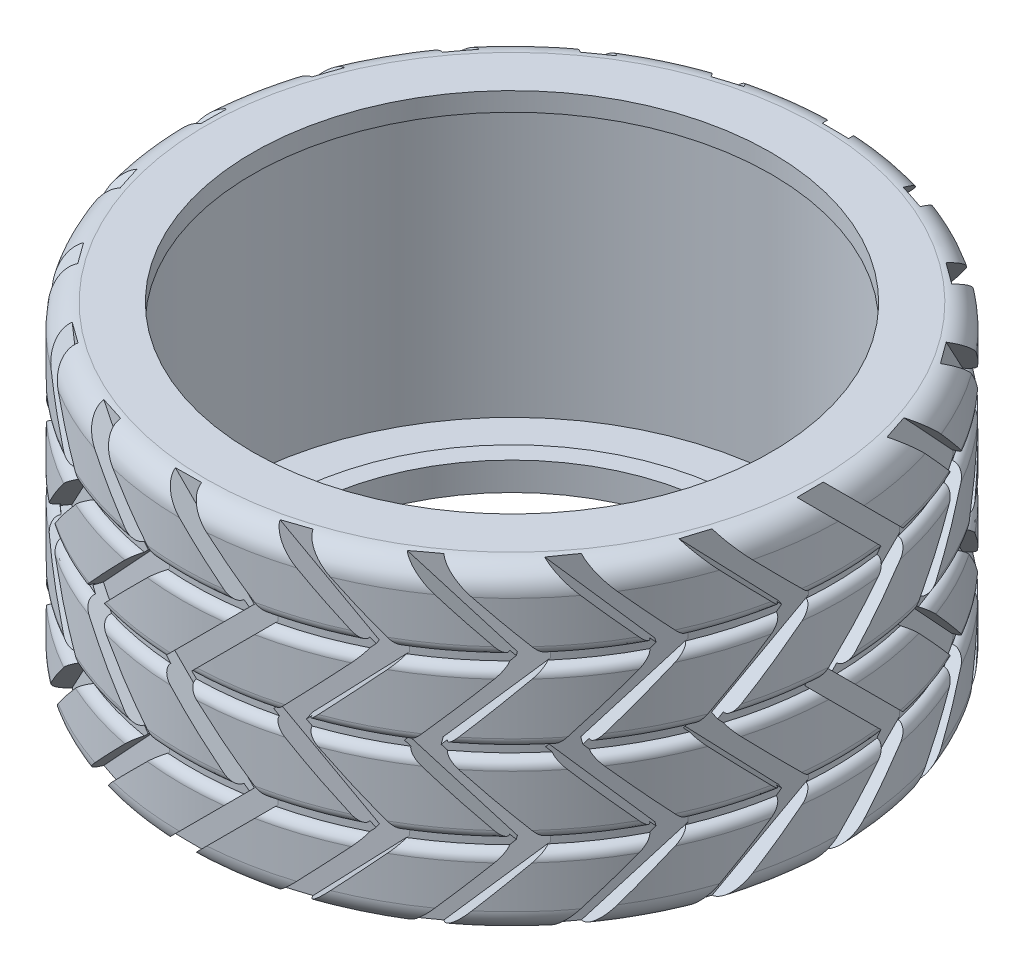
SolidWorks part; units mm, degrees
ref_plane "Front Plane" through (0, 0, 0) normal (0, 0, 1) x (1, 0, 0)
ref_plane "Top Plane" through (0, 0, 0) normal (0, 1, 0) x (1, 0, 0)
ref_plane "Right Plane" through (0, 0, 0) normal (1, 0, 0) x (0, 0, -1)
sketch "Sketch1" plane through (0, 0, 0) normal (0, 0, 1) x (1, 0, 0)
  line L0 (0, 83.6379) -> (0, -103.1897) construction
  line L1 (32.7, -17) -> (23.2, -17)
  line L2 (23.2, -17) -> (23.2, -14)
  line L3 (23.2, -14) -> (25.2, -14)
  line L4 (25.2, -14) -> (25.2, -15)
  line L5 (30.2, 15) -> (30.2, -15)
  line L6 (25.2, -15) -> (30.2, -15)
  line L7 (27.7, 15) -> (30.2, 15)
  line L10 (-63.3434, 0) -> (35.2, 0) construction
  line L12 (35.2, 14.5) -> (35.2, -14.5)
  line L13 (32.7, 17) -> (27.7, 17)
  line L14 (27.7, 15) -> (27.7, 17)
  arc A0 (35.2, -14.5) -> (32.7, -17) centre (32.7, -14.5) cw
  arc A1 (35.2, 14.5) -> (32.7, 17) centre (32.7, 14.5) ccw
  point P19 (34, -19)
  point P21 (30.2, 0)
  point P24 (34, 19)
  dimension "D8" = 2.5
  dimension "D1" = 30.2
  dimension "D2" = 2
  dimension "D3" = 2
  dimension "D4" = 15
  dimension "D5" = 3
  dimension "D6" = 5
  dimension "D7" = 5
  dimension "D9" = 5
  dimension "D10" = 2
revolve "Revolve1" add sketch "Sketch1" angle 360 about L0
sketch "Sketch2" plane through (0, 0, 0) normal (0, 0, 1) x (1, 0, 0)
  line L0 (-5.8704, 0) -> (53.8139, 0) construction
  line L1 (34.2, 9) -> (35.7422, 9)
  line L2 (34.2, 9) -> (34.2, 8)
  line L3 (34.2, 8) -> (35.7422, 8)
  line L4 (35.7422, 9) -> (35.7422, 8)
  line L5 (34.2, 0.5) -> (35.7422, 0.5)
  line L6 (34.2, 0.5) -> (34.2, -0.5)
  line L7 (34.2, -0.5) -> (35.7422, -0.5)
  line L8 (35.7422, 0.5) -> (35.7422, -0.5)
  line L9 (34.2, -8) -> (35.7422, -8)
  line L10 (34.2, -8) -> (34.2, -9)
  line L11 (34.2, -9) -> (35.7422, -9)
  line L12 (35.7422, -8) -> (35.7422, -9)
  line L13 (35.2, -14.5) -> (35.2, 14.5) construction
  line L14 (0, 29.8282) -> (0, -32.6074) construction
  line L15 (0, -32.6074) -> (-0.69, -32.6074) construction
  dimension "D1" = 1
  dimension "D2" = 1
  dimension "D3" = 9
revolve "Cut-Revolve1" cut sketch "Sketch2" angle 360 about L14
ref_plane "Plane1" through (35.2, 0, 0) normal (1, 0, 0) x (0, 0, -1)
fillet "Fillet2" radius 1 6 edges at (0, -8, -35.2) (0, -9, 35.2) (0, -0.5, 35.2) (0, 0.5, -35.2) (0, 8, 35.2) (0, 9, -35.2)
sketch "Sketch3" plane through (35.2, 0, 0) normal (1, 0, 0) x (0, 0, -1)
  line L0 (0, 0) -> (8.5, 8.5)
  line L1 (8.5, 8.5) -> (0, 17)
  line L2 (0, 0) -> (8.5, -8.5)
  line L3 (8.5, -8.5) -> (0, -17)
  line L4 (2.3901, 8.5) -> (13.9243, 8.5) construction
  line L5 (0, 18.3998) -> (0, -22.4709) construction
  line L6 (5.6716, 8.5) -> (-1.4142, 15.5858) construction
  line L7 (0, 17) -> (-2.8284, 17)
  line L8 (-0.3964, 14.568) -> (-2.8284, 17)
  line L9 (-1.4142, -15.5858) -> (-2.8284, -17)
  line L12 (5.6716, -8.5) -> (-1.4142, -15.5858)
  line L13 (-2.8284, 0) -> (5.6716, -8.5)
  line L14 (-2.8284, 0) -> (5.6716, 8.5)
  line L15 (5.6716, 8.5) -> (-0.3964, 14.568)
  line L16 (0, -17) -> (-2.8284, -17)
  line L17 (4.0358, -8.5) -> (10.0834, -8.5) construction
  line L20 (-34.2, -8) -> (34.2, -8) construction
  line L21 (-34.2, -9) -> (34.2, -9) construction
  line L22 (-34.2, 9) -> (34.2, 9) construction
  line L23 (-34.2, 8) -> (34.2, 8) construction
  point P28 (0, 0)
  dimension "D1" = 2
extrude "Cut-Extrude1" cut sketch "Sketch3" against normal blind 2
pattern_circular "CirPattern1" count 20 over 360 about axis through (0, 0, 0) along (0, 1, 0) of "Cut-Extrude1"
